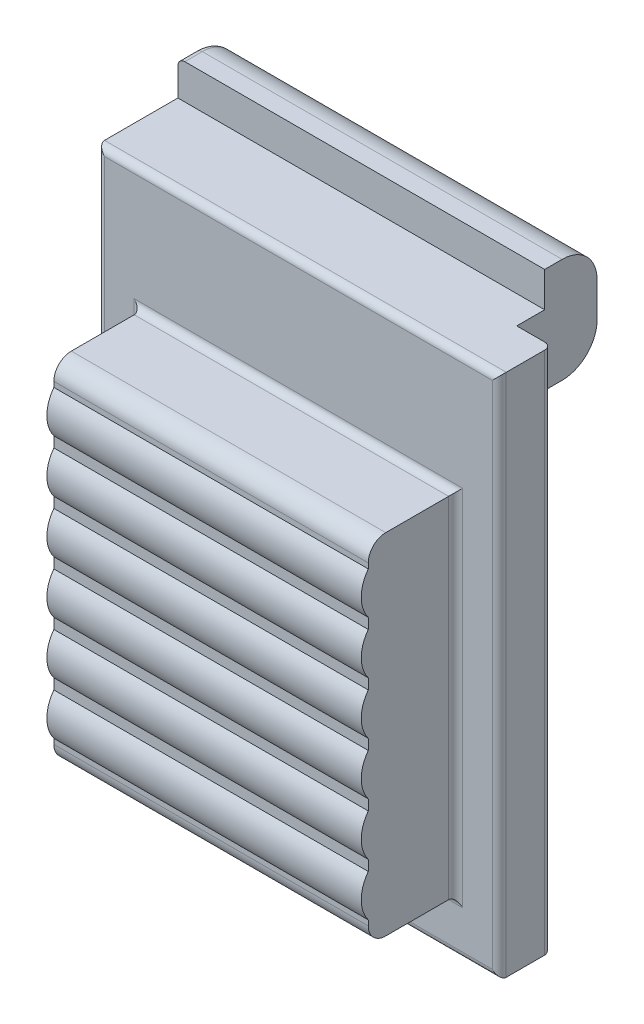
SolidWorks part; units mm, degrees
ref_plane "Plan1" through (0, 0, 0) normal (0, 0, 1) x (1, 0, 0)
ref_plane "Plan2" through (0, 0, 0) normal (0, 1, 0) x (1, 0, 0)
ref_plane "Plan3" through (0, 0, 0) normal (1, 0, 0) x (0, 0, -1)
sketch "Esquisse2" plane through (0, 0, 0) normal (0, 0, 1) x (1, 0, 0)
  line L1 (0, 0) -> (11.5, 0)
  line L2 (0, 0) -> (0, 15)
  line L3 (0, 15) -> (11.5, 15)
  line L4 (11.5, 0) -> (11.5, 15)
  dimension "D1" = 11.5
  dimension "D2" = 15
extrude "Base-Extrusion" add sketch "Esquisse2" along normal blind 1.5
sketch "Esquisse3" plane through (0, 0, 1.5) normal (0, 0, 1) x (1, 0, 0)
  line L0 (11.5, 15) -> (0, 15) construction
  line L1 (1.25, 11.5) -> (10.25, 11.5)
  line L2 (1.25, 11.5) -> (1.25, 1.5)
  line L3 (1.25, 1.5) -> (10.25, 1.5)
  line L4 (10.25, 11.5) -> (10.25, 1.5)
  line L5 (11.5, 0) -> (11.5, 15) construction
  dimension "D1" = 3.5
  dimension "D2" = 10
  dimension "D3" = 1.25
  dimension "D4" = 9
extrude "Boss.-Extru.1" add sketch "Esquisse3" along normal blind 2.5
sketch "Esquisse4" plane through (0, 0, 0) normal (0, 0, -1) x (-1, 0, 0)
  line L10 (-2.75, 3) -> (-8.75, 3)
  line L16 (-2.75, 10) -> (-2.75, 3)
  line L17 (-8.75, 10) -> (-2.75, 10)
  line L18 (-8.75, 3) -> (-8.75, 10)
extrude "Enlèv. mat.-Extru.1" cut sketch "Esquisse4" against normal blind 3
sketch "Esquisse5" plane through (0, 0, 0) normal (0, 0, -1) x (-1, 0, 0)
  line L0 (-11.5, 0) -> (-11.5, 15) construction
  line L1 (-10.5, 16) -> (0, 16)
  line L2 (-10.5, 16) -> (-10.5, 13)
  line L3 (-10.5, 13) -> (0, 13)
  line L4 (0, 16) -> (0, 13)
  dimension "D1" = 13
  dimension "D2" = 1
  dimension "D3" = 3
  dimension "D4" = 10.5
extrude "Boss.-Extru.2" add sketch "Esquisse5" along normal blind 2.3
fillet "Congé1" radius 1
fillet "Congé4" radius 0.2
fillet "Congé5" radius 0.2
sketch "Esquisse6" plane through (1.25, 0, 0) normal (-1, 0, 0) x (0, 0, 1)
  line L0 (3.3, 11.245) -> (3.3, 9.255)
  arc A0 (3.3, 9.255) -> (3.3, 11.245) centre (3.2, 10.25) ccw
  dimension "D1" = 3.2
  dimension "D2" = 2
  dimension "D3" = 10.25
  dimension "D4" = 3.3
extrude "Boss.-Extru.3" add sketch "Esquisse6" against normal blind 9
pattern_linear "Répétition linéaire1" count 6 spacing 1.5
fillet "Congé6" radius 0.5
fillet "Congé7" radius 0.2
fillet "Congé8" radius 0.2
sketch "Esquisse7" plane through (0, 0, 0) normal (0, 0, 1) x (1, 0, 0)
  line L1 (0, 15) -> (20, 15)
  line L2 (0, 15) -> (0, 20)
  line L3 (0, 20) -> (20, 20)
  line L4 (20, 15) -> (20, 20)
extrude "Enlèv. mat.-Extru.2" cut sketch "Esquisse7" against normal blind 0.8
